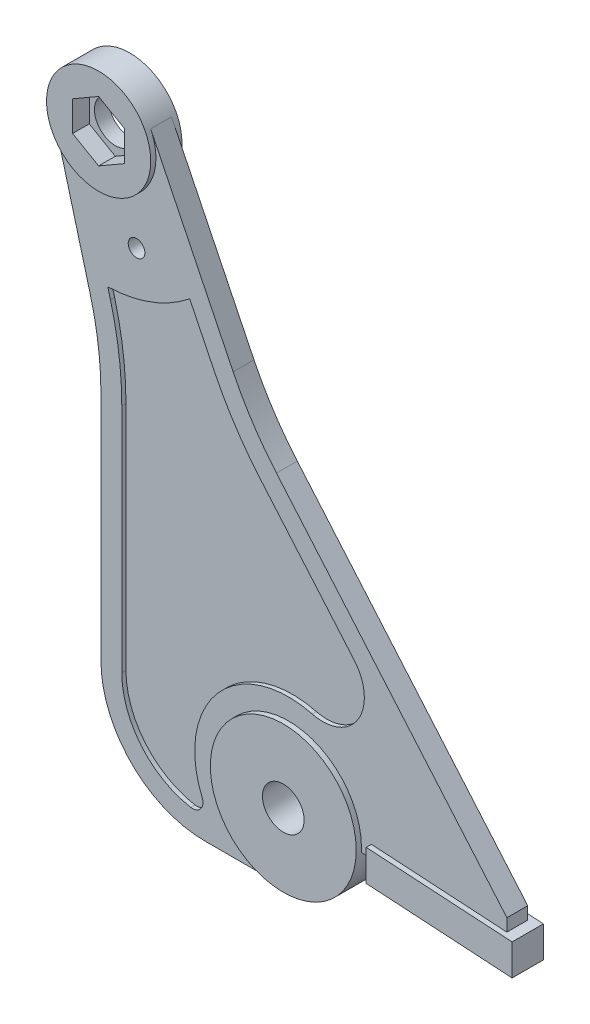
SolidWorks part; units mm, degrees
ref_plane "Front Plane" through (0, 0, 0) normal (0, 0, 1) x (1, 0, 0)
ref_plane "Top Plane" through (0, 0, 0) normal (0, 1, 0) x (1, 0, 0)
ref_plane "Right Plane" through (0, 0, 0) normal (1, 0, 0) x (0, 0, -1)
sketch "Sketch1" plane through (0, 0, 0) normal (0, 0, 1) x (1, 0, 0)
  line L0 (0, 0) -> (34.9347, -2.1367) construction
  line L1 (0, 0) -> (-88.6107, 237) construction
  line L2 (0, -1000) -> (0, 49000) construction
  line L3 (-1000, 0) -> (49000, 0) construction
  line L4 (34.9347, -2.1367) -> (104.8042, -6.4101)
  line L5 (104.8042, -6.4101) -> (104.8042, 5.5899)
  line L6 (104.8042, 5.5899) -> (-5.7821, 135.0697)
  line L7 (-112.7577, 230.5254) -> (-95.1177, 164.7365)
  line L8 (-26.5514, 166.7541) -> (-66.139, 247.9555)
  line L9 (0, -35) -> (-40, -35)
  line L11 (-90, 125.8891) -> (-90, 15)
  arc A0 (34.9347, -2.1367) -> (0, -35) centre (0, 0) ccw
  arc A1 (-112.7577, 230.5254) -> (-66.139, 247.9555) centre (-88.6107, 237) ccw
  arc A2 (-90, 15) -> (-40, -35) centre (-40, 15) ccw
  arc A3 (-26.5514, 166.7541) -> (-5.7821, 135.0697) centre (108.2788, 232.4869) ccw
  arc A4 (-90, 125.8891) -> (-95.1177, 164.7365) centre (-240, 125.8891) ccw
  circle A5 centre (-72.9075, 195) radius 4
  point P24 (-90, -35)
  point P25 (-90, 145.6499)
  point P26 (-18.1835, 149.5899)
  dimension "D1" = 70
  dimension "D9" = 50
  dimension "D15" = 50
  dimension "D16" = 150
  dimension "D17" = 150
  dimension "D18" = 8
  dimension "D10" = 195
  dimension "D2" = 3.5
  dimension "D3" = 20.5
  dimension "D4" = 144
  dimension "D5" = 12
  dimension "D6" = 70
  dimension "D7" = 20
  dimension "D8" = 272
  dimension "D12" = 40
extrude "Boss-Extrude1" add sketch "Sketch1" along normal mid plane 10
sketch "Sketch2" plane through (0, 0, 0) normal (0, 0, 1) x (1, 0, 0)
  circle A0 centre (0, 0) radius 35
  circle A1 centre (0, 0) radius 10
  circle A2 centre (-88.6107, 237) radius 25
  circle A3 centre (-88.6107, 237) radius 10
  dimension "D1" = 20
  dimension "D2" = 50
  dimension "D3" = 20
extrude "Boss-Extrude2" add sketch "Sketch2" along normal mid plane 15
sketch "Sketch3" plane through (0, 0, 0) normal (0, 0, 1) x (1, 0, 0)
  line L0 (39.8042, 3.5767) -> (39.8042, -11.4233)
  line L1 (39.8042, -11.4233) -> (109.8042, -15.7047)
  line L2 (109.8042, -15.7047) -> (109.8042, -0.7047)
  line L3 (109.8042, -0.7047) -> (39.8042, 3.5767)
  line L4 (34.9347, -2.1367) -> (104.8042, -6.4101) construction
  line L5 (104.8042, -6.4101) -> (104.8042, 5.5899) construction
  dimension "D1" = 15
  dimension "D2" = 6
  dimension "D3" = 5
  dimension "D4" = 70
extrude "Boss-Extrude3" add sketch "Sketch3" along normal mid plane 15
sketch "Sketch4" plane through (0, 0, 5) normal (0, 0, 1) x (1, 0, 0)
  line L0 (-990.8622, -64.9065) -> (49009.1378, -64.9065) construction
  line L1 (-85.4589, 167.3263) -> (-86.7194, 172.0275)
  line L4 (97.2001, -0.9046) -> (-13.3861, 128.5752)
  line L5 (-80, 125.8891) -> (-80, 15)
  line L6 (31.6166, 75.8838) -> (-13.3861, 128.5752)
  line L8 (-35.5401, 162.3719) -> (-75.1276, 243.5733)
  line L9 (-35.5401, 162.3719) -> (-47.4122, 186.7239)
  arc A1 (11.3597, 43.5426) -> (-41.4471, -17.5255) centre (0, 0) ccw
  arc A2 (-86.7194, 172.0275) -> (-47.4122, 186.7239) centre (-88.6107, 237) ccw
  arc A3 (-46.9169, -24.3974) -> (-41.4471, -17.5255) centre (-46.0523, -19.4727) ccw
  arc A4 (-35.5401, 162.3719) -> (-13.3861, 128.5752) centre (108.2788, 232.4869) ccw
  arc A5 (-80, 125.8891) -> (-85.4589, 167.3263) centre (-240, 125.8891) ccw
  arc A6 (-80, 125.8891) -> (-85.4589, 167.3263) centre (-240, 125.8891) ccw
  arc A7 (-35.5401, 162.3719) -> (-13.3861, 128.5752) centre (108.2788, 232.4869) ccw
  arc A8 (-80, 15) -> (-40, -25) centre (-40, 15) ccw
  arc A9 (-80, 15) -> (-46.9169, -24.3974) centre (-40, 15) ccw
  arc A10 (11.3597, 43.5426) -> (31.6166, 75.8838) centre (16.4085, 62.8948) ccw
  dimension "D1" = 90
  dimension "D2" = 130
  dimension "D8" = 10
  dimension "D9" = 40
  dimension "D3" = 10
  dimension "D4" = 10
  dimension "D5" = 10
  dimension "D6" = 10
  dimension "D7" = 10
extrude "Cut-Extrude1" cut sketch "Sketch4" against normal blind 2
mirror "Mirror1" about plane through (0, 0, 0) normal (0, 0, 1) of "Cut-Extrude1"
sketch "Sketch5" plane through (0, 0, 7.5) normal (0, 0, 1) x (1, 0, 0)
  line L1 (-88.6107, 222.5662) -> (-76.1107, 229.7831)
  line L2 (-76.1107, 229.7831) -> (-76.1107, 244.2169)
  line L3 (-76.1107, 244.2169) -> (-88.6107, 251.4338)
  line L4 (-88.6107, 251.4338) -> (-101.1107, 244.2169)
  line L5 (-101.1107, 244.2169) -> (-101.1107, 229.7831)
  line L6 (-101.1107, 229.7831) -> (-88.6107, 222.5662)
  circle A0 centre (-88.6107, 237) radius 12.5 construction
  dimension "D1" = 25
extrude "Cut-Extrude2" cut sketch "Sketch5" against normal blind 8
